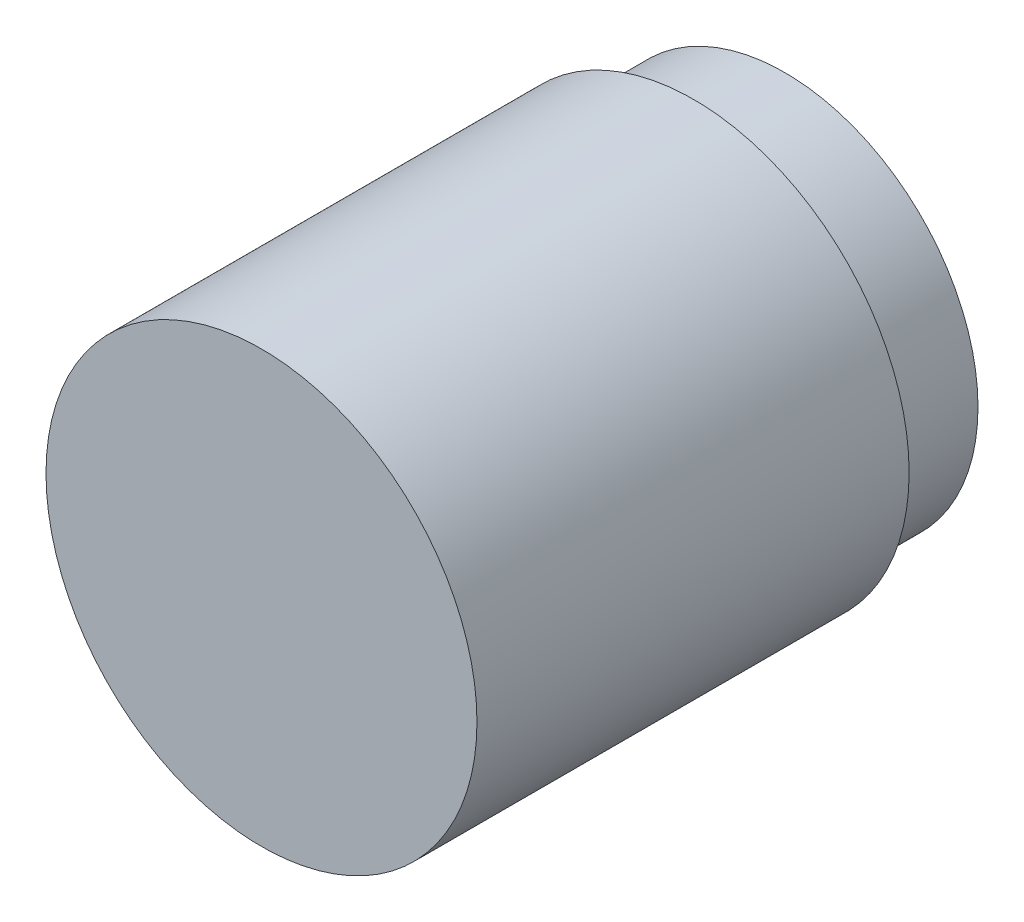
SolidWorks part; units mm, degrees
ref_plane "Front" through (0, 0, 0) normal (0, 0, 1) x (1, 0, 0)
ref_plane "Top" through (0, 0, 0) normal (0, 1, 0) x (1, 0, 0)
ref_plane "Right" through (0, 0, 0) normal (1, 0, 0) x (0, 0, -1)
sketch "Sketch1" plane through (0, 0, 0) normal (0, 0, 1) x (1, 0, 0)
  circle A0 centre (0, 0) radius 14.85
  dimension "D1" = 29.7
extrude "Extrude1" add sketch "Sketch1" along normal blind 36.068
sketch "Sketch2" plane through (0, 0, 0) normal (0, 1, 0) x (1, 0, 0)
  line L0 (0, 0) -> (0, -9.2558) construction
  line L2 (14.85, 0) -> (-14.85, 0) construction
  line L3 (14.85, 0) -> (13.31, 0)
  line L4 (14.85, 0) -> (14.85, -6.2865)
  line L5 (14.85, -6.2865) -> (13.31, -6.2865)
  line L6 (13.31, 0) -> (13.31, -6.2865)
  line L8 (14.85, -36.068) -> (14.85, 0) construction
  dimension "D1" = 26.62
  dimension "D2" = 6.2865
revolve "Cut-Revolve1" cut sketch "Sketch2" angle 360 about L0
